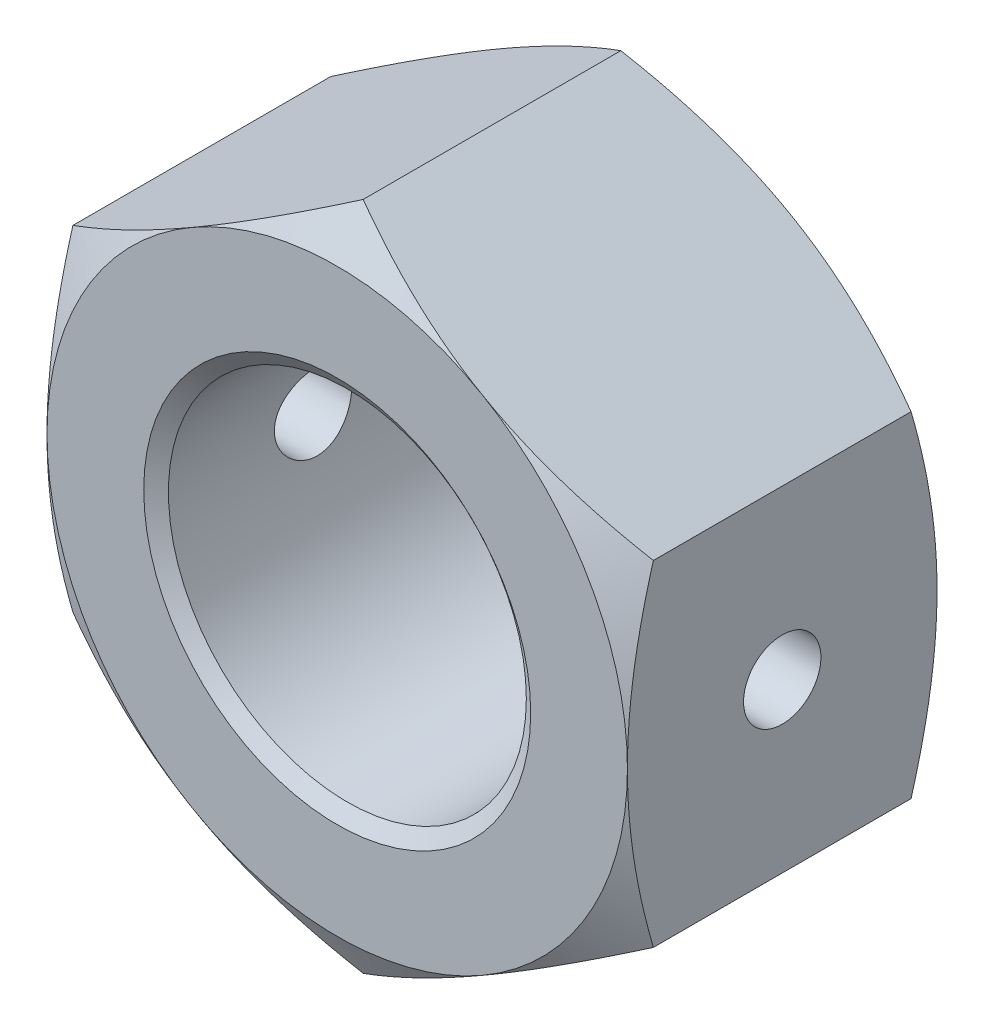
SolidWorks part; units mm, degrees
extrude "BaseNut" add sketch "BaseNutSke" against normal blind 16
sketch "BaseNutSke" plane through (0, 0, 0) normal (0, 0, 1) x (1, 0, 0)
  line L6 (15, 8.6603) -> (15, -8.6603)
  line L7 (-15, 8.6603) -> (-15, -8.6603)
  line L8 (15, 8.6603) -> (0, 17.3205)
  line L9 (0, 17.3205) -> (-15, 8.6603)
  line L10 (-15, -8.6603) -> (0, -17.3205)
  line L11 (0, -17.3205) -> (15, -8.6603)
  circle A0 centre (0, 0) radius 9.25
pattern_linear "ThdSchPat" [suppressed]
revolve "ThreadSchematic" cut sketch "ThdSchSke" angle 360 about L6
sketch "ThdSchSke" plane through (0, 0, 0) normal (0, 1, 0) x (1, 0, 0)
  line L0 (-10, 0.0254) -> (-9.25, 0.5506)
  line L1 (-9.25, 0.5506) -> (-4.625, 0.5506)
  line L2 (-4.625, 0.5506) -> (-4.625, -0.4998)
  line L3 (-4.625, -0.4998) -> (-9.25, -0.4998)
  line L4 (-9.25, -0.4998) -> (-10, 0.0254)
  line L5 (-3.175, 2.5) -> (3.175, 2.5) construction
  line L6 (0, 2.5) -> (0, -2.9874) construction
  line L7 (0, 15.4494) -> (0, 0.5252) construction
ref_plane "Plane1" through (0, 0, 0) normal (0, 0, 1) x (1, 0, 0)
ref_plane "Plane2" through (0, 0, 0) normal (0, 1, 0) x (1, 0, 0)
ref_plane "Plane3" through (0, 0, 0) normal (1, 0, 0) x (0, 0, -1)
sketch "Sketch3" plane through (0, 0, 0) normal (1, 0, 0) x (0, 0, -1)
  line L0 (16, 15) -> (14.6603, 17.3205)
  line L1 (14.6603, 17.3205) -> (14.6603, 27.3205)
  line L2 (14.6603, 27.3205) -> (26, 27.3205)
  line L3 (26, 27.3205) -> (26, 15)
  line L4 (26, 15) -> (16, 15)
  line L5 (16, 8.6603) -> (16, 17.3205) construction
  line L6 (16, 17.3205) -> (0, 17.3205) construction
  line L7 (0, 0) -> (38.6776, 0) construction
  line L8 (16, 0) -> (0, 0) construction
  line L9 (8, 17.3205) -> (8, 44.222) construction
  line L10 (1.3397, 27.3205) -> (-10, 27.3205)
  line L11 (-10, 27.3205) -> (-10, 15)
  line L12 (-10, 15) -> (0, 15)
  line L13 (0, 15) -> (1.3397, 17.3205)
  line L14 (1.3397, 17.3205) -> (1.3397, 27.3205)
  line L16 (16, 17.3205) -> (0, 17.3205) construction
revolve "Double-Chamfer" cut sketch "Sketch3" angle 360 about L7
sketch "Sketch5" plane through (0, 0, 0) normal (1, 0, 0) x (0, 0, -1)
  line L0 (15.9746, 10) -> (15.0118, 8.625)
  line L1 (16.0254, 10) -> (15.9746, 10)
  line L2 (16.0254, 10) -> (16.0254, 8.625)
  line L3 (16.0254, 8.625) -> (15.0118, 8.625)
  line L6 (-0.0508, 10) -> (0, 10)
  line L7 (0, 10) -> (0.9628, 8.625)
  line L9 (0.9628, 8.625) -> (-0.0508, 8.625)
  line L10 (-0.0508, 8.625) -> (-0.0508, 10)
  line L11 (25.0375, 0) -> (38.388, 0) construction
  line L12 (16, 0) -> (0, 0) construction
revolve "EndChamfer" cut sketch "Sketch5" angle 360 about L11
thread "Filetage1" pitch 2.5 start angle 0, offset 5, length 25, pitch 2.5, diameter 18.5
ref_plane "Plan1" through (9.25, 0, -20.4494) normal (0, -1, 0) x (1, 0, 0)
sketch "Profil de filetage1" plane through (9.25, 0, -20.4494) normal (0, -1, 0) x (1, 0, 0)
  line L0 (0, 0) -> (0, 2.5) construction
  line L1 (0, 0) -> (1.3532, 0.7812)
  line L2 (1.3532, 0.7812) -> (1.3532, 1.0937)
  line L3 (1.3532, 1.0937) -> (0, 1.875)
  line L4 (1.3532, 0.9375) -> (0, 0.9375) construction
  line L11 (0, 0) -> (0, 1.875)
  point P2 (0, 0)
  dimension "Pitch" = 2.5
  dimension "Profile_Angle" = 60
  dimension "Profile_Land" = 0.3125
  dimension "Profile_Height" = 1.3532
sketch "Esquisse4" plane through (-15, 0, 0) normal (-1, 0, 0) x (0, 0, 1)
  circle A0 centre (-8, 0) radius 2
  dimension "D1" = 4
  dimension "D2" = 8
extrude "Enlèv. mat.-Extru.1" cut sketch "Esquisse4" against normal through all
equation "\"D2@BaseNutSke\" = \"Width_flats@BaseNutSke\" / 2"
equation "\"D3@BaseNutSke\" = \"Width_flats@BaseNutSke\" / 2"
equation "\"D1@Sketch3\" = \"Width_flats@BaseNutSke\" /2"
equation "\"D4@BaseNutSke\" = \"D3@BaseNutSke\""
equation "\"Tap_Drill@ThdSchSke\" = \"Tap_drill@BaseNutSke\""
equation "\"OverCut@ThdSchSke\" = \"Tap_Drill@ThdSchSke\" * 0.5"
equation "\"Num_threads@ThdSchPat\" = int(  ( \"Thickness@BaseNut\" - 0.0508 ) / \"Advance@ThdSchSke\" + 0.999 )  + 1"
equation "\"Advance@ThdSchPat\" = ( \"Thickness@BaseNut\" - 0.0508 ) /  (\"Num_threads@ThdSchPat\" - 1) 'relax it"
equation "' \"Num_threads@ThdSchPat\" = \"Num_threads@ThdSchPat\" - sgn( \"Num_threads@ThdSchPat\" - 1) '---chamfered tips only---"
equation "\"Offset1@Sketch5\" = \"Thickness@BaseNut\" + 0.0254"
equation "\"Offset2@Sketch5\" = \"Offset1@Sketch5\" + 0.0508"
